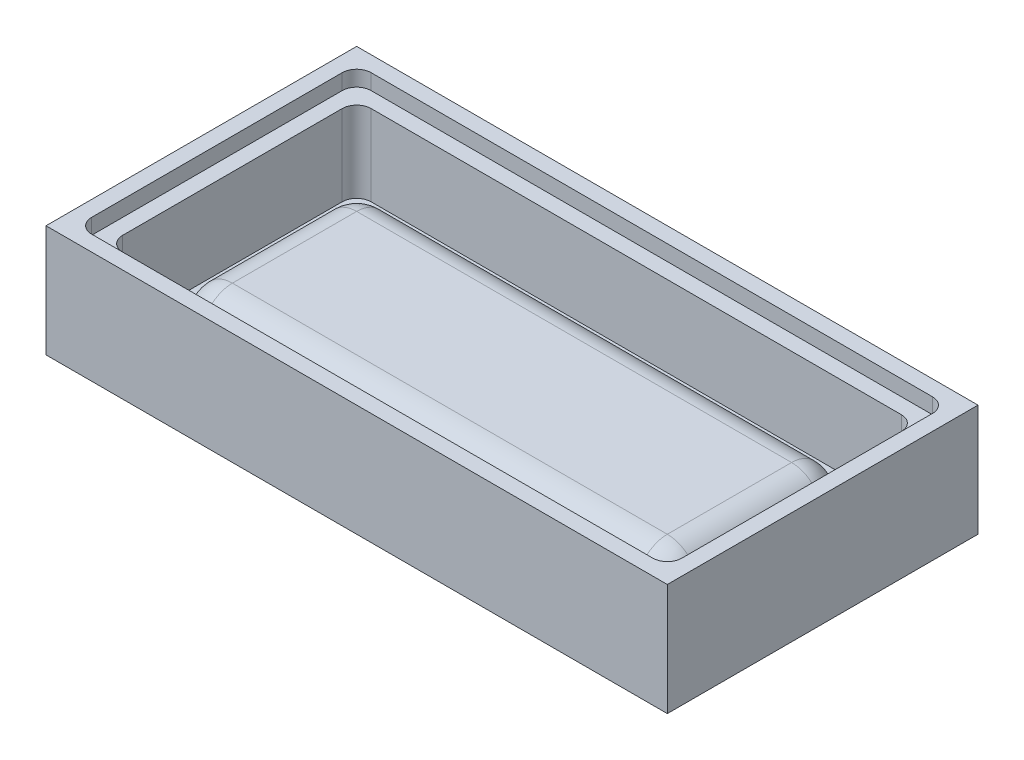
SolidWorks part; units mm, degrees
ref_plane "Front Plane" through (0, 0, 0) normal (0, 0, 1) x (1, 0, 0)
ref_plane "Top Plane" through (0, 0, 0) normal (0, 1, 0) x (1, 0, 0)
ref_plane "Right Plane" through (0, 0, 0) normal (1, 0, 0) x (0, 0, -1)
sketch "Sketch1" plane through (0, 0, 0) normal (0, 1, 0) x (1, 0, 0)
  line L1 (-100, 50) -> (100, 50)
  line L2 (-100, 50) -> (-100, -50)
  line L3 (-100, -50) -> (100, -50)
  line L4 (100, 50) -> (100, -50)
  line L5 (-100, 50) -> (100, -50) construction
  line L6 (-100, -50) -> (100, 50) construction
  point P0 (0, 0)
  dimension "D1" = 200
  dimension "D2" = 100
extrude "Boss-Extrude1" add sketch "Sketch1" along normal blind 36
sketch "Sketch2" plane through (0, 36, 0) normal (0, 1, 0) x (1, 0, 0)
  line L0 (100, 50) -> (-100, 50) construction
  line L1 (-90.3358, 45) -> (90.3358, 45)
  line L2 (-95, 40.3358) -> (-95, -40.3358)
  line L3 (-90.3358, -45) -> (90.3358, -45)
  line L4 (95, 40.3358) -> (95, -40.3358)
  line L5 (-95, 45) -> (95, -45) construction
  line L6 (-95, -45) -> (95, 45) construction
  line L7 (-100, 50) -> (-100, -50) construction
  arc A0 (90.3358, 45) -> (95, 40.3358) centre (90.3358, 40.3358) cw
  arc A1 (90.3358, -45) -> (95, -40.3358) centre (90.3358, -40.3358) ccw
  arc A2 (-90.3358, 45) -> (-95, 40.3358) centre (-90.3358, 40.3358) ccw
  arc A3 (-95, -40.3358) -> (-90.3358, -45) centre (-90.3358, -40.3358) ccw
  point P0 (0, 0)
  dimension "D3" = 4.6642
  dimension "D1" = 5
  dimension "D2" = 5
extrude "Cut-Extrude1" cut sketch "Sketch2" against normal blind 5
sketch "Sketch3" plane through (0, 31, 0) normal (0, 1, 0) x (1, 0, 0)
  line L22 (90, -35.3358) -> (90, 35.3358)
  line L23 (-85.3358, -40) -> (85.3358, -40)
  line L24 (-90, 35.3358) -> (-90, -35.3358)
  line L25 (85.3358, 40) -> (-85.3358, 40)
  arc A0 (90, 35.3358) -> (85.3358, 40) centre (85.3358, 35.3358) ccw
  arc A1 (90, -35.3358) -> (85.3358, -40) centre (85.3358, -35.3358) cw
  arc A2 (-85.3358, -40) -> (-90, -35.3358) centre (-85.3358, -35.3358) cw
  arc A3 (-90, 35.3358) -> (-85.3358, 40) centre (-85.3358, 35.3358) cw
  dimension "D2" = 4.6642
extrude "Cut-Extrude2" cut sketch "Sketch3" against normal blind 26
sketch "Sketch4" plane through (0, 5, 0) normal (0, 1, 0) x (1, 0, 0)
  line L8 (-80, -30) -> (80, -30)
  line L9 (80, -30) -> (80, 30)
  line L10 (80, 30) -> (-80, 30)
  line L11 (-80, 30) -> (-80, -30)
  line L12 (-80, -30) -> (80, -30)
  line L13 (80, -30) -> (80, 30)
  line L14 (80, 30) -> (-80, 30)
  line L15 (-80, 30) -> (-80, -30)
  dimension "D1" = 10
extrude "Boss-Extrude2" add sketch "Sketch4" along normal blind 15
fillet "Fillet1" radius 10 8 edges at (0, 20, -30) (80, 20, 0) (0, 20, 30) (-80, 20, 0) (80, 12.5, 30) (80, 12.5, -30) (-80, 12.5, 30) (-80, 12.5, -30)
